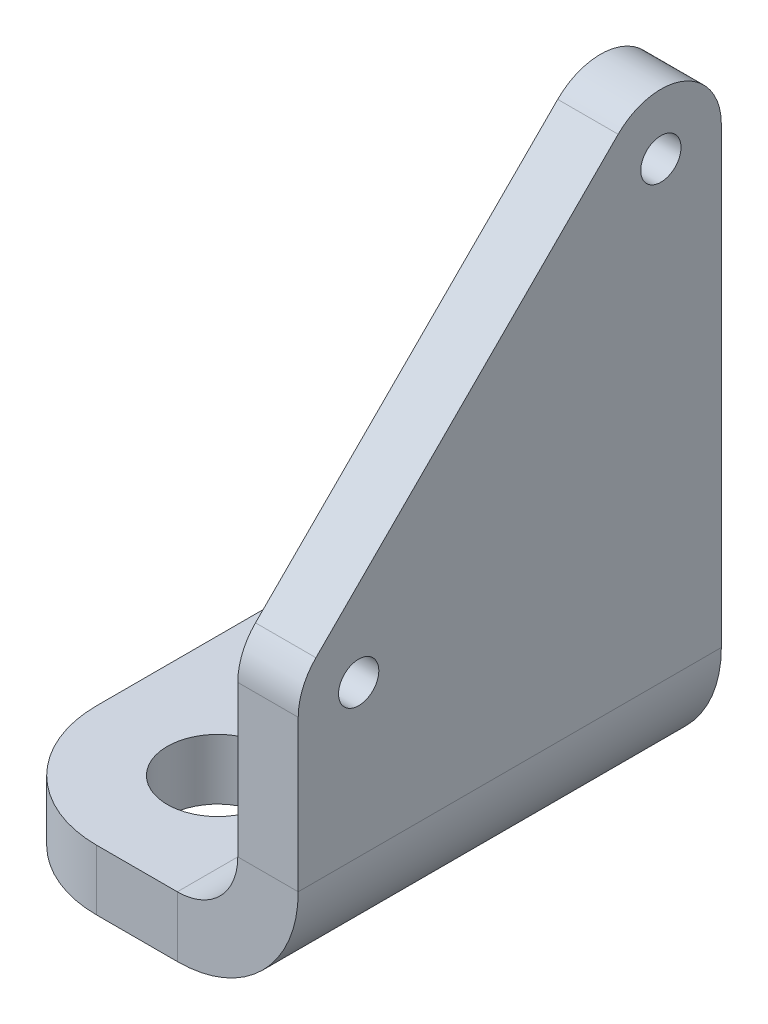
SolidWorks part; units mm, degrees
ref_plane "Frontal" through (0, 0, 0) normal (0, 0, 1) x (1, 0, 0)
ref_plane "Horizontal" through (0, 0, 0) normal (0, 1, 0) x (1, 0, 0)
ref_plane "Vertical" through (0, 0, 0) normal (1, 0, 0) x (0, 0, -1)
mirrored part "equerre d_Rendre symétrique"
other "<equerre d>-<Pliage 1>"
